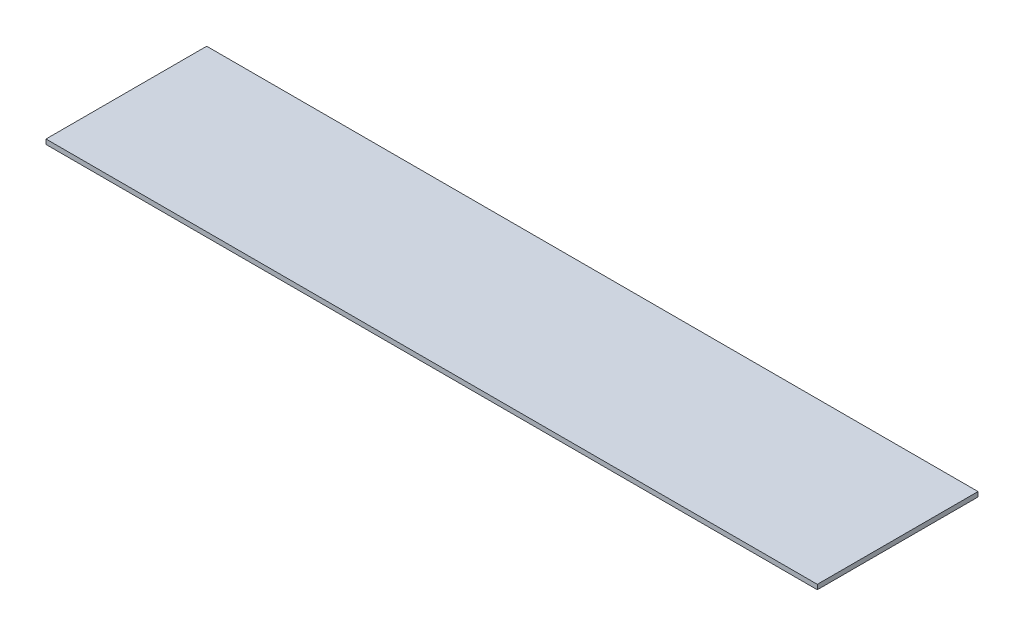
SolidWorks part; units mm, degrees
ref_plane "Front Plane" through (0, 0, 0) normal (0, 0, 1) x (1, 0, 0)
ref_plane "Top Plane" through (0, 0, 0) normal (0, 1, 0) x (1, 0, 0)
ref_plane "Right Plane" through (0, 0, 0) normal (1, 0, 0) x (0, 0, -1)
sketch "Sketch1" plane through (0, 0, 0) normal (0, 1, 0) x (1, 0, 0)
  line L1 (0, 0) -> (487.68, 0)
  line L2 (0, 0) -> (0, 101.6)
  line L3 (0, 101.6) -> (487.68, 101.6)
  line L4 (487.68, 0) -> (487.68, 101.6)
  dimension "D1" = 101.6
  dimension "D2" = 487.68
extrude "Boss-Extrude1" add sketch "Sketch1" along normal blind 3
